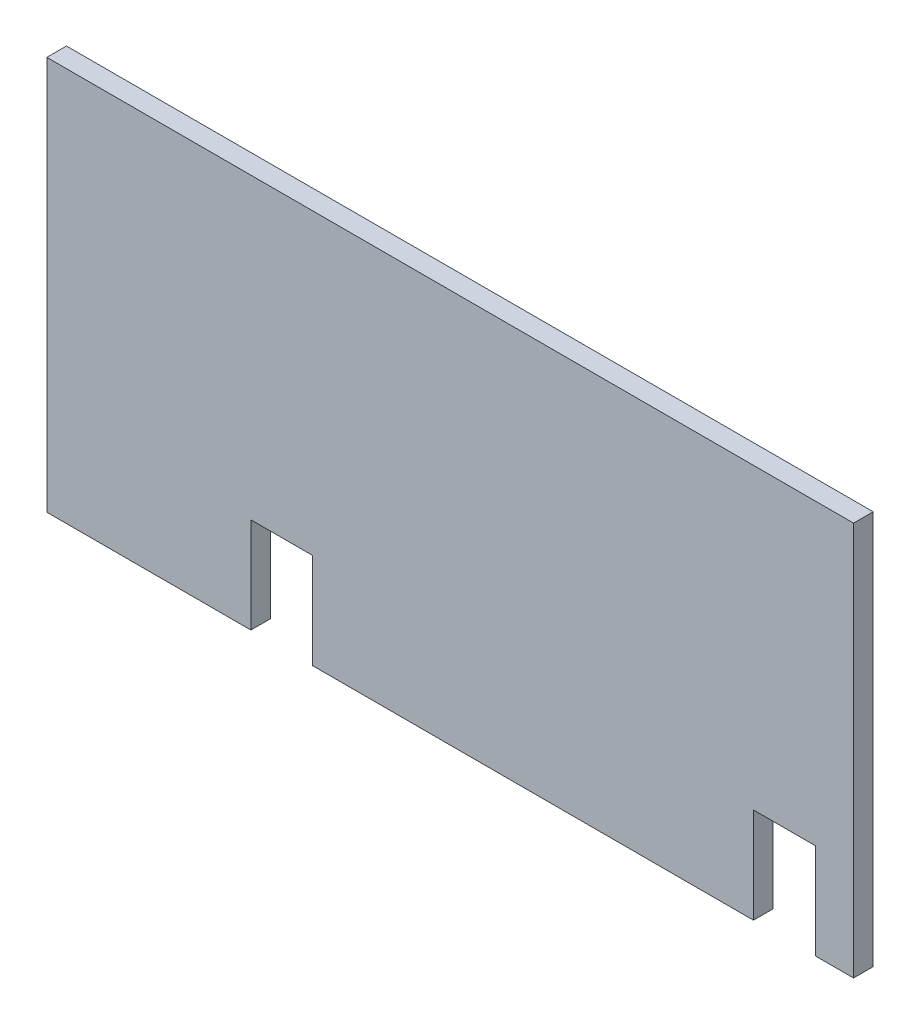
SolidWorks part; units mm, degrees
ref_plane "Front Plane" through (0, 0, 0) normal (0, 0, 1) x (1, 0, 0)
ref_plane "Top Plane" through (0, 0, 0) normal (0, 1, 0) x (1, 0, 0)
ref_plane "Right Plane" through (0, 0, 0) normal (1, 0, 0) x (0, 0, -1)
sketch "Sketch1" plane through (0, 0, 0) normal (0, 0, 1) x (1, 0, 0)
  line L0 (-114.046, -17.425) -> (-17.526, -17.425) construction
  line L1 (-120.396, -17.425) -> (-94, -17.425)
  line L2 (-120.396, -17.425) -> (-120.396, 33.528)
  line L3 (-120.396, 33.528) -> (-16.05, 33.528)
  line L4 (-16.05, -17.425) -> (-16.05, 33.528)
  line L5 (98.9319, 33.528) -> (-120.396, 33.528) construction
  line L6 (-120.396, 33.528) -> (-120.396, 20.828) construction
  line L7 (-16.05, -19) -> (-16.05, 2.54) construction
  line L8 (-21, -19) -> (-21, -5.08) construction
  line L9 (-29, -5.08) -> (-21, -5.08)
  line L10 (-29, -5.08) -> (-29, -17.425)
  line L11 (-21, -17.425) -> (-16.05, -17.425)
  line L12 (-21, -5.08) -> (-21, -17.425)
  line L13 (-86, -5.08) -> (-86, -19) construction
  line L14 (-94, -5.08) -> (-86, -5.08)
  line L15 (-94, -5.08) -> (-94, -17.425)
  line L17 (-86, -5.08) -> (-86, -17.425)
  line L18 (-86, -17.425) -> (-29, -17.425)
extrude "Boss-Extrude1" add sketch "Sketch1" along normal blind 2.54
